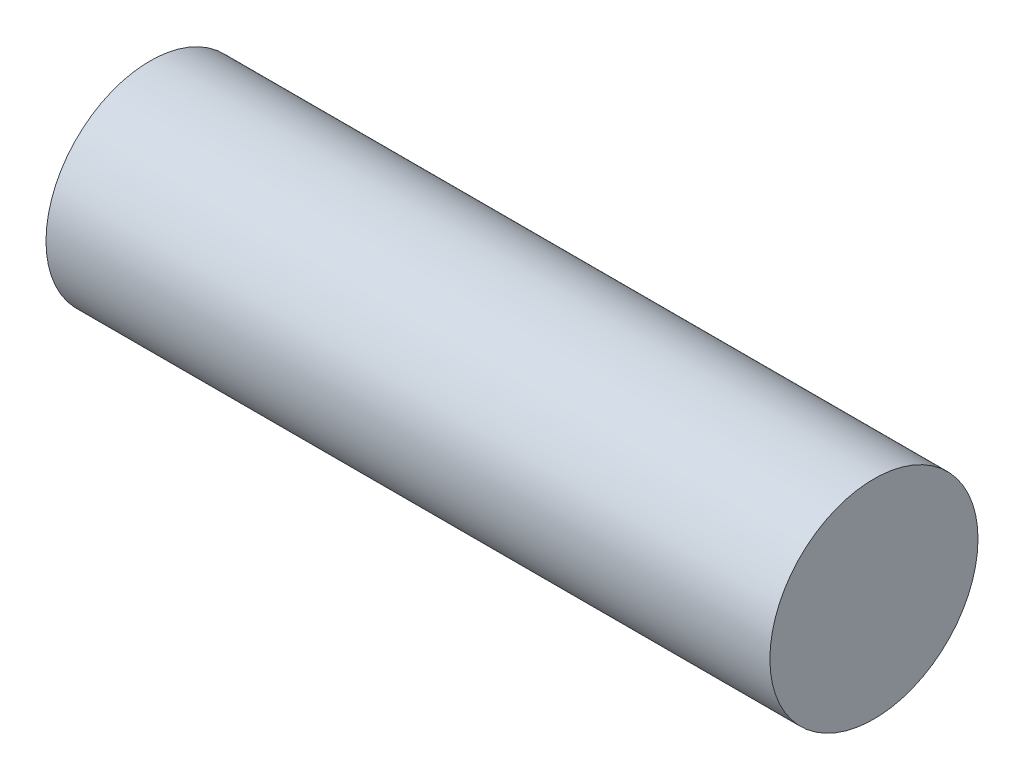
SolidWorks part; units mm, degrees
ref_plane "Front Plane" through (0, 0, 0) normal (0, 0, 1) x (1, 0, 0)
ref_plane "Top Plane" through (0, 0, 0) normal (0, 1, 0) x (1, 0, 0)
ref_plane "Right Plane" through (0, 0, 0) normal (1, 0, 0) x (0, 0, -1)
sketch "Sketch1" plane through (0, 0, 0) normal (1, 0, 0) x (0, 0, -1)
  circle A0 centre (0, 0) radius 1.4605
  dimension "D1" = 2.921
extrude "Boss-Extrude1" add sketch "Sketch1" along normal mid plane 10.16
